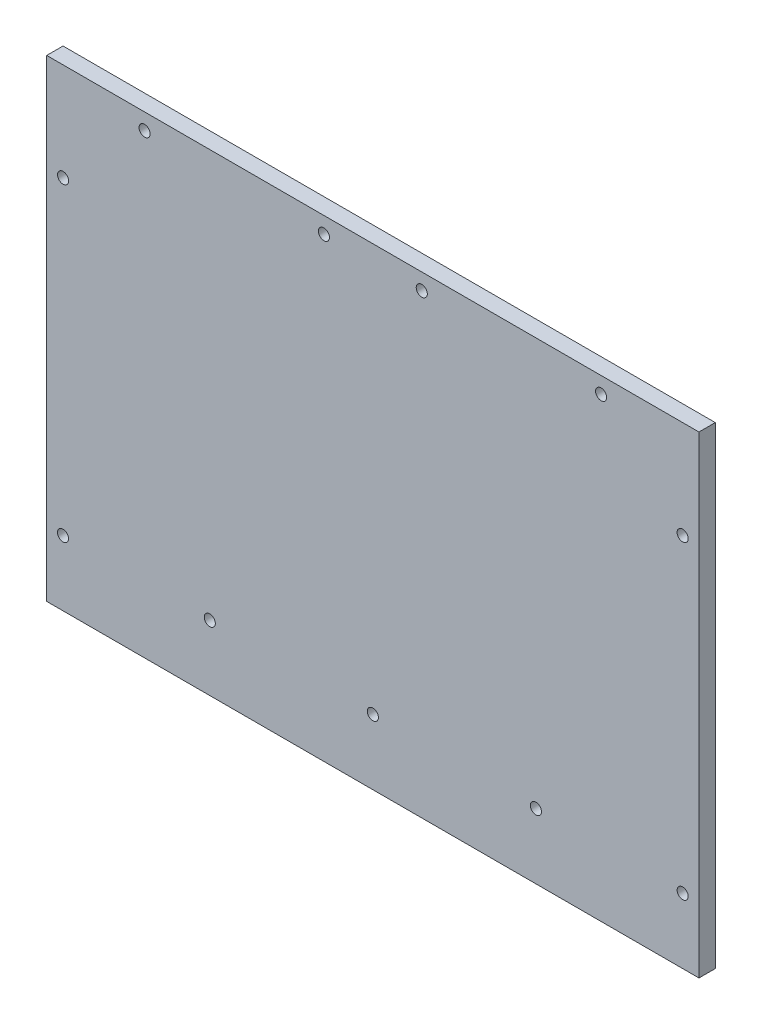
SolidWorks part; units mm, degrees
ref_plane "前视基准面" through (0, 0, 0) normal (0, 0, 1) x (1, 0, 0)
ref_plane "上视基准面" through (0, 0, 0) normal (0, 1, 0) x (1, 0, 0)
ref_plane "右视基准面" through (0, 0, 0) normal (1, 0, 0) x (0, 0, -1)
other "Configuration Table"
sketch "草图1" plane through (0, 0, 0) normal (0, 0, 1) x (1, 0, 0)
  line L1 (-100, 72.5) -> (100, 72.5)
  line L2 (-100, 72.5) -> (-100, -72.5)
  line L3 (-100, -72.5) -> (100, -72.5)
  line L4 (100, 72.5) -> (100, -72.5)
  line L5 (-100, 72.5) -> (100, -72.5) construction
  line L6 (-100, -72.5) -> (100, 72.5) construction
  point P0 (0, 0)
  dimension "D1" = 200
  dimension "D2" = 145
extrude "凸台-拉伸1" add sketch "草图1" along normal blind 5
hole_wizard "M3 十字槽沉头木螺钉的锥形沉头孔1" positions "草图2" profile "草图3" countersink size "M3" standard "GB"
sketch "草图2" plane through (0, 0, 0) normal (0, 0, -1) x (-1, 0, 0)
  line L0 (-100, 72.5) -> (100, 72.5) construction
  line L1 (-100, -72.5) -> (-100, 72.5) construction
  line L2 (100, 72.5) -> (100, -72.5) construction
  line L3 (100, -72.5) -> (-100, -72.5) construction
  point P0 (-70, 67.5)
  point P2 (70, 67.5)
  point P8 (-95, -52.5)
  point P10 (95, -52.5)
  point P12 (-15, 67.5)
  point P14 (15, 67.5)
  dimension "D1" = 5
  dimension "D2" = 30
  dimension "D3" = 5
  dimension "D4" = 30
  dimension "D5" = 5
  dimension "D6" = 5
  dimension "D7" = 85
  dimension "D8" = 85
  dimension "D9" = 5
  dimension "D10" = 5
  dimension "D11" = 20
  dimension "D12" = 20
sketch "草图3" plane through (70, 67.5, 0) normal (1, 0, 0) x (0, 1, 0)
  line L0 (0, 0) -> (0, 12.5215)
  line L1 (0, 12.5215) -> (1.7, 11.5)
  line L2 (1.7, 11.5) -> (1.7, 1.6)
  line L3 (1.7, 1.6) -> (3.3, 0)
  line L5 (3.3, 0) -> (0, 0)
  line L6 (-1.7, 1.6) -> (-3.3, 0) construction
  line L10 (0, 12.5215) -> (-1.7, 11.5) construction
  line L11 (0, -6.35) -> (0, 107.95) construction
  dimension "孔直径" = 3.4
  dimension "孔深度" = 11.5
  dimension "近端锥形沉头孔直径" = 6.6
  dimension "近端锥形沉头孔角度" = 90
  dimension "导头角度" = 118
hole_wizard "M3 十字槽沉头木螺钉的锥形沉头孔3" positions "草图6" profile "草图7" countersink size "M3" standard "GB"
sketch "草图6" plane through (0, 0, 0) normal (0, 0, -1) x (-1, 0, 0)
  line L0 (-100, -72.5) -> (-100, 72.5) construction
  line L1 (100, -72.5) -> (-100, -72.5) construction
  point P0 (-50, -52.5)
  point P2 (0, -52.5)
  point P4 (50, -52.5)
  dimension "D1" = 100
  dimension "D2" = 20
  dimension "D3" = 20
  dimension "D4" = 20
  dimension "D5" = 50
  dimension "D6" = 50
sketch "草图7" plane through (50, -52.5, 0) normal (1, 0, 0) x (0, 1, 0)
  line L0 (0, 0) -> (0, 8.0215)
  line L1 (0, 8.0215) -> (1.7, 7)
  line L2 (1.7, 7) -> (1.7, 1.6)
  line L3 (1.7, 1.6) -> (3.3, 0)
  line L5 (3.3, 0) -> (0, 0)
  line L6 (-1.7, 1.6) -> (-3.3, 0) construction
  line L10 (0, 8.0215) -> (-1.7, 7) construction
  line L11 (0, -6.35) -> (0, 107.95) construction
  dimension "孔直径" = 3.4
  dimension "孔深度" = 7
  dimension "近端锥形沉头孔直径" = 6.6
  dimension "近端锥形沉头孔角度" = 90
  dimension "导头角度" = 118
hole_wizard "M3 十字槽沉头木螺钉的锥形沉头孔4" positions "草图8" profile "草图9" countersink size "M3" standard "GB"
sketch "草图8" plane through (0, 0, 0) normal (0, 0, -1) x (-1, 0, 0)
  line L0 (-100, -72.5) -> (-100, 72.5) construction
  line L1 (100, 72.5) -> (100, -72.5) construction
  line L2 (-100, 72.5) -> (100, 72.5) construction
  point P0 (-95, 42.5)
  point P2 (95, 42.5)
  dimension "D1" = 5
  dimension "D2" = 5
  dimension "D3" = 30
  dimension "D4" = 30
sketch "草图9" plane through (95, 42.5, 0) normal (1, 0, 0) x (0, 1, 0)
  line L0 (0, 0) -> (0, 5)
  line L1 (0, 5) -> (1.7, 5)
  line L2 (1.7, 5) -> (1.7, 1.6)
  line L3 (1.7, 1.6) -> (3.3, 0)
  line L5 (3.3, 0) -> (0, 0)
  line L6 (-1.7, 1.6) -> (-3.3, 0) construction
  line L11 (0, -6.35) -> (0, 107.95) construction
  dimension "通孔孔直径" = 3.4
  dimension "通孔孔深度" = 5
  dimension "近端锥形沉头孔直径" = 6.6
  dimension "近端锥形沉头孔角度" = 90
